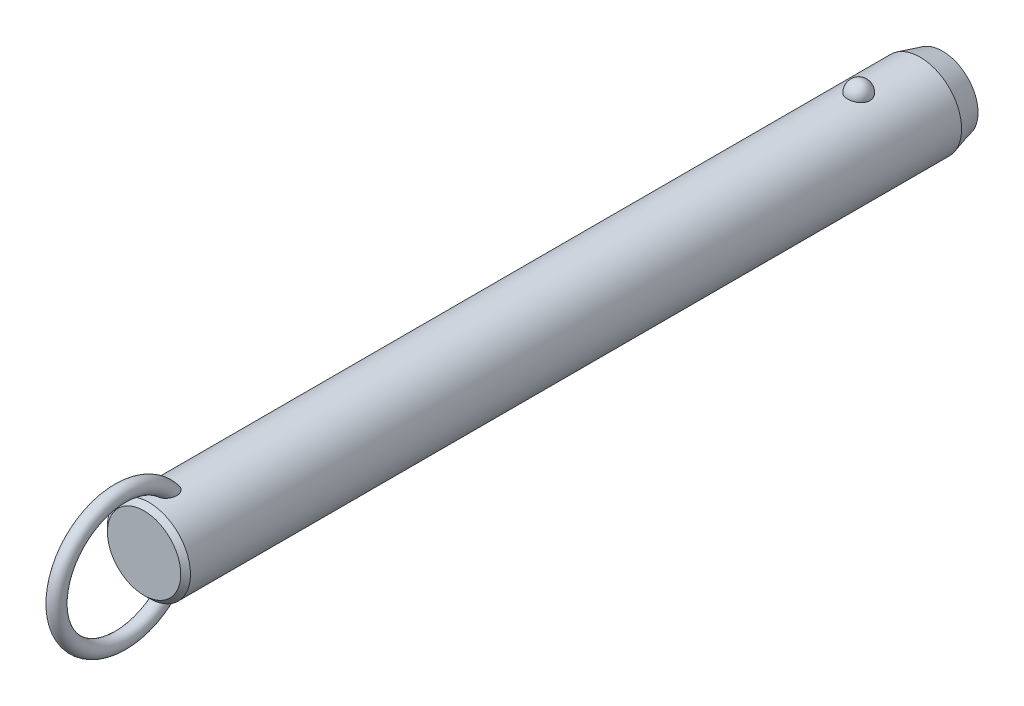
SolidWorks part; units mm, degrees
ref_plane "Front Plane" through (0, 0, 0) normal (0, 0, 1) x (1, 0, 0)
ref_plane "Top Plane" through (0, 0, 0) normal (0, 1, 0) x (1, 0, 0)
ref_plane "Right Plane" through (0, 0, 0) normal (1, 0, 0) x (0, 0, -1)
sketch "Sketch2" plane through (0, 0, 0) normal (0, 0, 1) x (1, 0, 0)
  circle A0 centre (0, 0) radius 11.1
  point P3 (0, 11.1)
  dimension "D1" = 22.2
extrude "Boss-Extrude1" add sketch "Sketch2" along normal blind 175.3
sketch "Sketch3" plane through (0, 0, 0) normal (0, 0, -1) x (-1, 0, 0)
  circle A0 centre (0, 0) radius 11.1
  dimension "D1" = 22.2
extrude "Boss-Extrude2" add sketch "Sketch3" along normal blind 25.4
chamfer "Chamfer1" distance 6 angle 15 1 edges at (-11.1, 0, -25.4)
sketch "Sketch12" plane through (0, 0, 0) normal (1, 0, 0) x (0, 0, -1)
  line L0 (-175.3, 11.1) -> (-175.3, -11.1) construction
  point P0 (-175.3, 0)
sketch "Sketch13" plane through (0, 0, 0) normal (1, 0, 0) x (0, 0, -1)
  circle A0 centre (-194.35, 0) radius 19.05
  point P2 (-175.3, 0)
  dimension "D1" = 38.1
sketch "Sketch14" plane through (0, 0, 0) normal (0, 1, 0) x (1, 0, 0)
  circle A0 centre (0, -177.3) radius 2
  point P2 (0, -175.3)
  dimension "D1" = 4
sweep "Sweep1" add profiles "Sketch14" path "Sketch13"
sketch "Sketch15" plane through (0, 0, 175.3) normal (0, 0, 1) x (1, 0, 0)
  circle A0 centre (0, 0) radius 11.1
  dimension "D1" = 22.2
extrude "Boss-Extrude3" add sketch "Sketch15" along normal blind 12.7
chamfer "Chamfer2" distance 1.3 angle 45 1 edges at (11.1, 0, 188)
sketch "Sketch18" plane through (0, 0, 0) normal (1, 0, 0) x (0, 0, -1)
  line L0 (19.4, 11.1) -> (-178.868, 11.1) construction
  line L1 (3, 14.1) -> (3, 8.1)
  line L2 (-178.868, -11.1) -> (19.4, -11.1) construction
  arc A0 (3, 14.1) -> (3, 8.1) centre (3, 11.1) ccw
  point P4 (0, 11.1)
  dimension "D1" = 25.2
revolve "Revolve1" add sketch "Sketch18" angle 360 about L1
